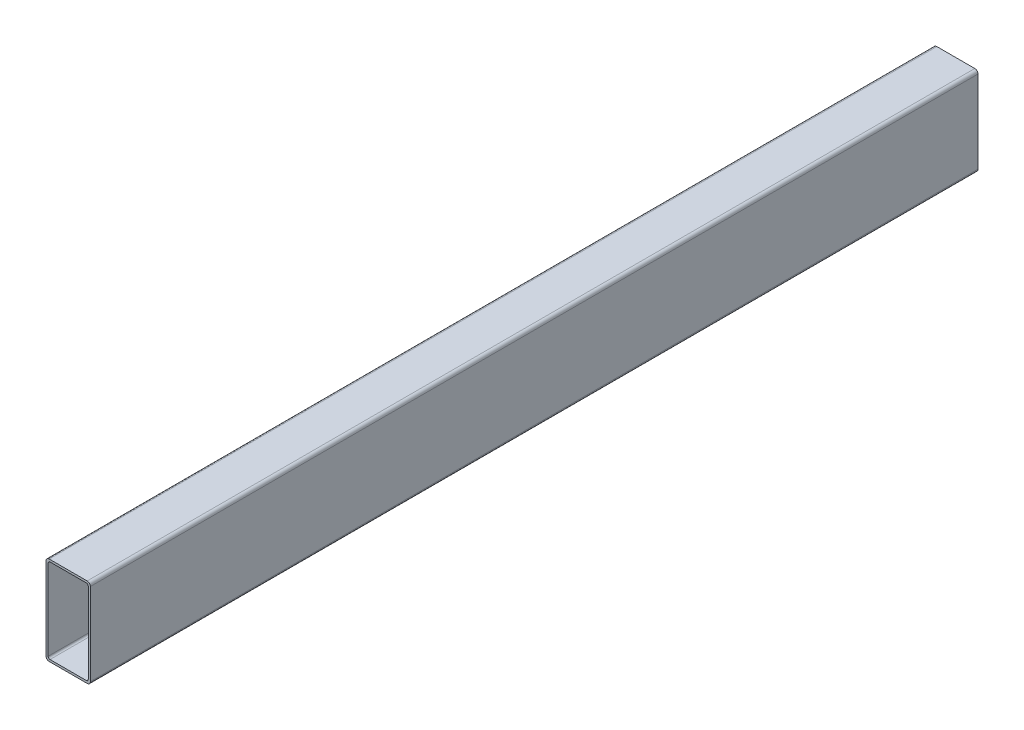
SolidWorks part; units mm, degrees
ref_plane "前视基准面" through (0, 0, 0) normal (0, 0, 1) x (1, 0, 0)
ref_plane "上视基准面" through (0, 0, 0) normal (0, 1, 0) x (1, 0, 0)
ref_plane "右视基准面" through (0, 0, 0) normal (1, 0, 0) x (0, 0, -1)
sketch "草图1" plane through (0, 0, 0) normal (0, 0, 1) x (1, 0, 0)
  line L0 (0, -23.8) -> (0, 0) construction
  line L1 (-10.252, 23.8) -> (10.252, 23.8)
  line L2 (-11.3, 22.752) -> (-11.3, -22.752)
  line L3 (-10.252, -23.8) -> (10.252, -23.8)
  line L4 (11.3, 22.752) -> (11.3, -22.752)
  line L5 (-10.704, 25) -> (10.704, 25)
  line L6 (-12.5, 23.204) -> (-12.5, -23.204)
  line L7 (-10.704, -25) -> (10.704, -25)
  line L8 (12.5, 23.204) -> (12.5, -23.204)
  line L9 (0, 0) -> (0, 23.8) construction
  arc A0 (10.704, 25) -> (12.5, 23.204) centre (10.704, 23.204) cw
  arc A1 (10.704, -25) -> (12.5, -23.204) centre (10.704, -23.204) ccw
  arc A2 (-12.5, -23.204) -> (-10.704, -25) centre (-10.704, -23.204) ccw
  arc A3 (-10.704, 25) -> (-12.5, 23.204) centre (-10.704, 23.204) ccw
  arc A4 (-10.252, 23.8) -> (-11.3, 22.752) centre (-10.252, 22.752) ccw
  arc A5 (10.252, 23.8) -> (11.3, 22.752) centre (10.252, 22.752) cw
  arc A6 (-11.3, -22.752) -> (-10.252, -23.8) centre (-10.252, -22.752) ccw
  arc A7 (10.252, -23.8) -> (11.3, -22.752) centre (10.252, -22.752) ccw
  point P4 (0, 23.8)
  point P5 (11.3, 0)
  point P10 (0, 25)
  point P11 (12.5, 0)
  dimension "rx" = 1.796
  dimension "ry" = 1.048
  dimension "A" = 50
  dimension "B" = 25
  dimension "D3" = 1.2
  dimension "t" = 1.2
extrude "拉伸1" add sketch "草图1" along normal blind 500
sketch "草图2" plane through (0, 0, 0) normal (0, 1, 0) x (1, 0, 0)
  line L0 (0, 0) -> (0, -500)
  dimension "D1" = 500
equation "\"D3@草图1\" = \"t@草图1\""
equation "\"D1@草图2\" = \"D1@拉伸1\""
